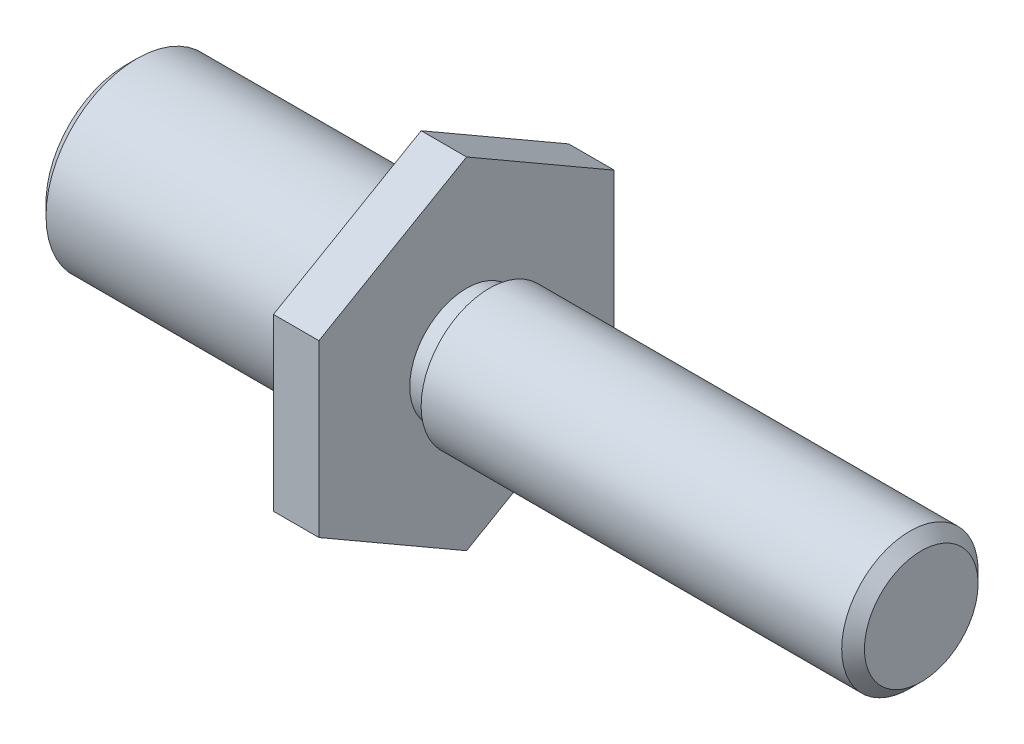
SolidWorks part; units mm, degrees
ref_plane "Plan1" through (0, 0, 0) normal (0, 0, 1) x (1, 0, 0)
ref_plane "Plan2" through (0, 0, 0) normal (0, 1, 0) x (1, 0, 0)
ref_plane "Plan3" through (0, 0, 0) normal (1, 0, 0) x (0, 0, -1)
sketch "Esquisse1" plane through (0, 0, 0) normal (0, 0, 1) x (1, 0, 0)
  line L0 (0, 0) -> (0, 4)
  line L1 (0, 4) -> (12, 4)
  line L2 (12, 4) -> (12, 3.5)
  line L3 (12, 3.5) -> (13, 3.5)
  line L4 (13, 3.5) -> (13, 7.5)
  line L5 (13, 7.5) -> (15, 7.5)
  line L6 (15, 7.5) -> (15, 2.5)
  line L7 (15, 2.5) -> (16, 2.5)
  line L8 (16, 2.5) -> (16, 3)
  line L9 (16, 3) -> (35, 3)
  line L10 (35, 3) -> (35, 0)
  line L11 (35, 0) -> (0, 0)
  line L12 (0, 0) -> (71, 0) construction
  dimension "D1" = 3
  dimension "D2" = 4
  dimension "D3" = 1
  dimension "D4" = 1
  dimension "D5" = 12
  dimension "D6" = 2
  dimension "D7" = 19
  dimension "D8" = 7.5
  dimension "D9" = 3.5
  dimension "D10" = 2.5
revolve "Base-Révolution" add sketch "Esquisse1" angle 360 about L12
chamfer "Chanfrein1" distance 0.5 angle 45
sketch "Esquisse3" plane through (0, 0, 0) normal (1, 0, 0) x (0, 0, -1)
  line L0 (-6.4952, 3.75) -> (-6.4952, -3.75)
  line L1 (-6.4952, -3.75) -> (0, -7.5)
  line L2 (0, -7.5) -> (6.4952, -3.75)
  line L3 (6.4952, -3.75) -> (6.4952, 3.75)
  line L4 (6.4952, 3.75) -> (0, 7.5)
  line L5 (0, 7.5) -> (-6.4952, 3.75)
  line L6 (0, 0) -> (0, 13) construction
  circle A0 centre (0, 0) radius 7.5 construction
  dimension "D1" = 7.5
  dimension "D2" = 7.5
  dimension "D3" = 120
  dimension "D4" = 120
extrude "Enlèv. mat.-Extru.2" cut sketch "Esquisse3" along normal through all flip side to cut
